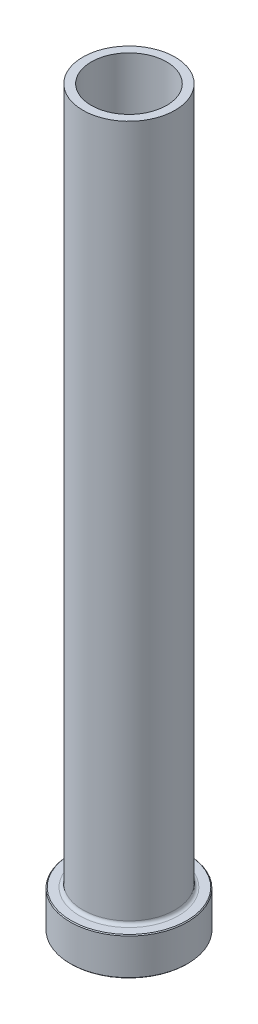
SolidWorks part; units mm, degrees
ref_plane "Front Plane" through (0, 0, 0) normal (0, 0, 1) x (1, 0, 0)
ref_plane "Top Plane" through (0, 0, 0) normal (0, 1, 0) x (1, 0, 0)
ref_plane "Right Plane" through (0, 0, 0) normal (1, 0, 0) x (0, 0, -1)
sketch "Sketch1" plane through (0, 0, 0) normal (0, 0, 1) x (1, 0, 0)
  line L0 (-9, 175) -> (-11, 175)
  line L1 (-11, 175) -> (-11, 9)
  line L2 (-11, 9) -> (-14, 9)
  line L3 (-14, 9) -> (-14, 0)
  line L4 (15.4, 0) -> (-15.4, 0) construction
  line L5 (-14, 0) -> (-9.25, 0)
  line L6 (-9, 120) -> (-9, 175)
  line L7 (0, 92.1877) -> (0, -15.5353) construction
  line L8 (0, -15.4) -> (0, 15.4) construction
  line L9 (-9, 120) -> (-9.25, 108)
  line L10 (-9.25, 108) -> (-9.25, 0)
  dimension "D1" = 0.25
  dimension "ID" = 18
  dimension "OD" = 22
  dimension "L" = 175
  dimension "H" = 28
  dimension "T" = 9
  dimension "N" = 55
  dimension "D2" = 12
revolve "Revolve1" add sketch "Sketch1" angle 360 about L7
fillet "Fillet1" radius 0.8 1 edges at (0, 9, 11)
chamfer "Chamfer1" distance 0.2 angle 45 2 edges at (0, 9, 14) (0, 0, 14)
chamfer "Chamfer3" distance 0.5 angle 45 1 edges at (0, 0, 9.25)
